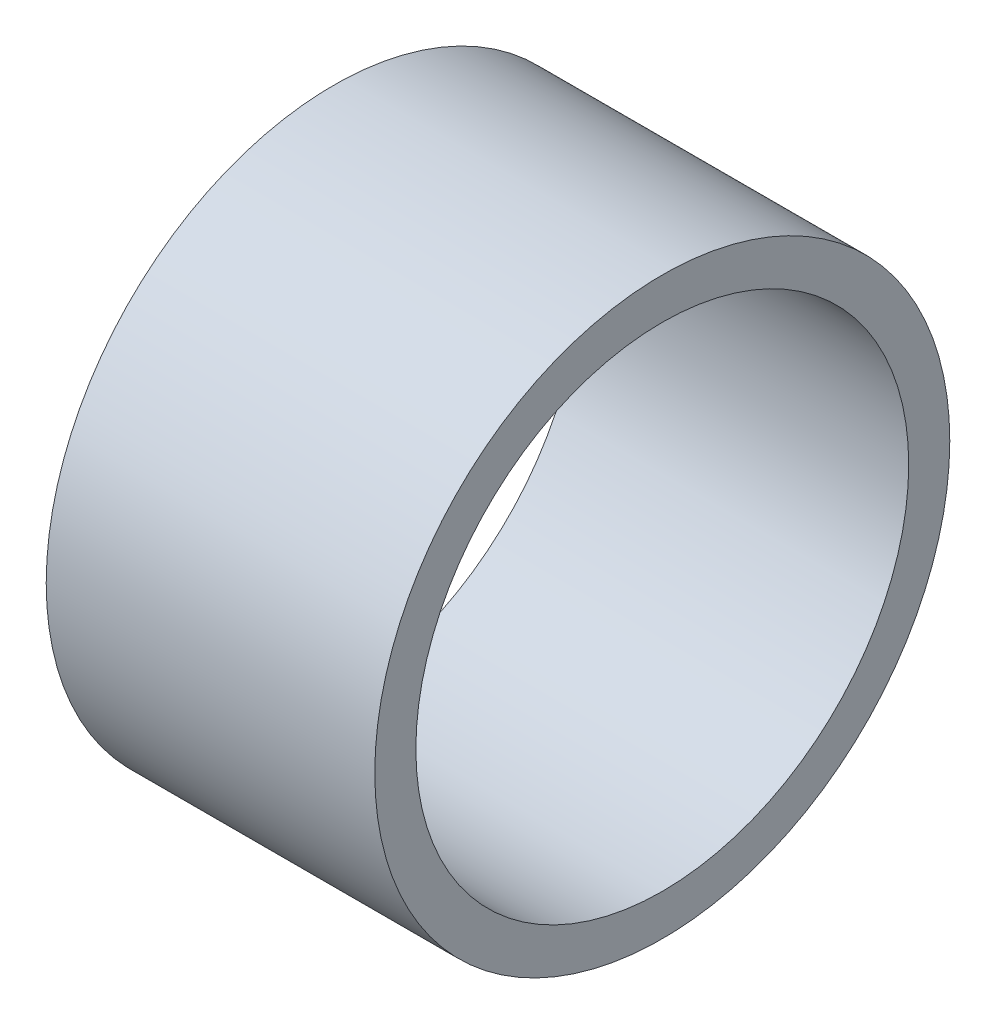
SolidWorks part; units mm, degrees
ref_plane "Front" through (0, 0, 0) normal (0, 0, 1) x (1, 0, 0)
ref_plane "Top" through (0, 0, 0) normal (0, 1, 0) x (1, 0, 0)
ref_plane "Right" through (0, 0, 0) normal (1, 0, 0) x (0, 0, -1)
sketch "Sketch1" plane through (0, 0, 0) normal (0, 0, 1) x (1, 0, 0)
  line L0 (0, 0) -> (50.8, 0)
  line L1 (9.9848, 0) -> (-9.9848, 0) construction
  dimension "D1" = 50.8
other "Structural Member1"
ref_plane "Plane1" through (0, 0, 0) normal (1, 0, 0) x (0, 0, -1)
sketch "Sketch11" plane through (0, 0, 0) normal (1, 0, 0) x (0, 0, -1)
  circle A0 centre (0, 0) radius 38.1
  circle A1 centre (0, 0) radius 44.45
  point P3 (0, 0)
  dimension "D1" = 88.9
  dimension "D2" = 76.2
ref_plane "Plane2" through (0, 0, 44.45) normal (0, 0, 1) x (1, 0, 0)
